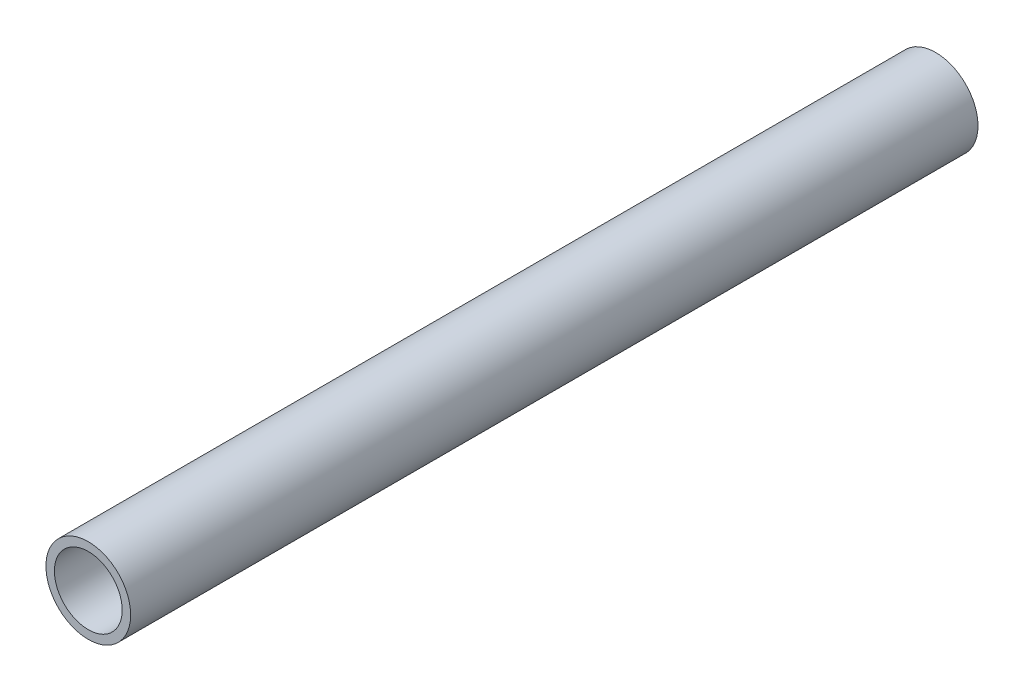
SolidWorks part; units mm, degrees
ref_plane "Front" through (0, 0, 0) normal (0, 0, 1) x (1, 0, 0)
ref_plane "Top" through (0, 0, 0) normal (0, 1, 0) x (1, 0, 0)
ref_plane "Right" through (0, 0, 0) normal (1, 0, 0) x (0, 0, -1)
sketch "Эскиз1" plane through (0, 0, 0) normal (0, 0, 1) x (1, 0, 0)
  circle A0 centre (-8.3947, 5.565) radius 5
  circle A1 centre (-8.3947, 5.565) radius 4
extrude "Вытянуть1" add sketch "Эскиз1" along normal blind 100
